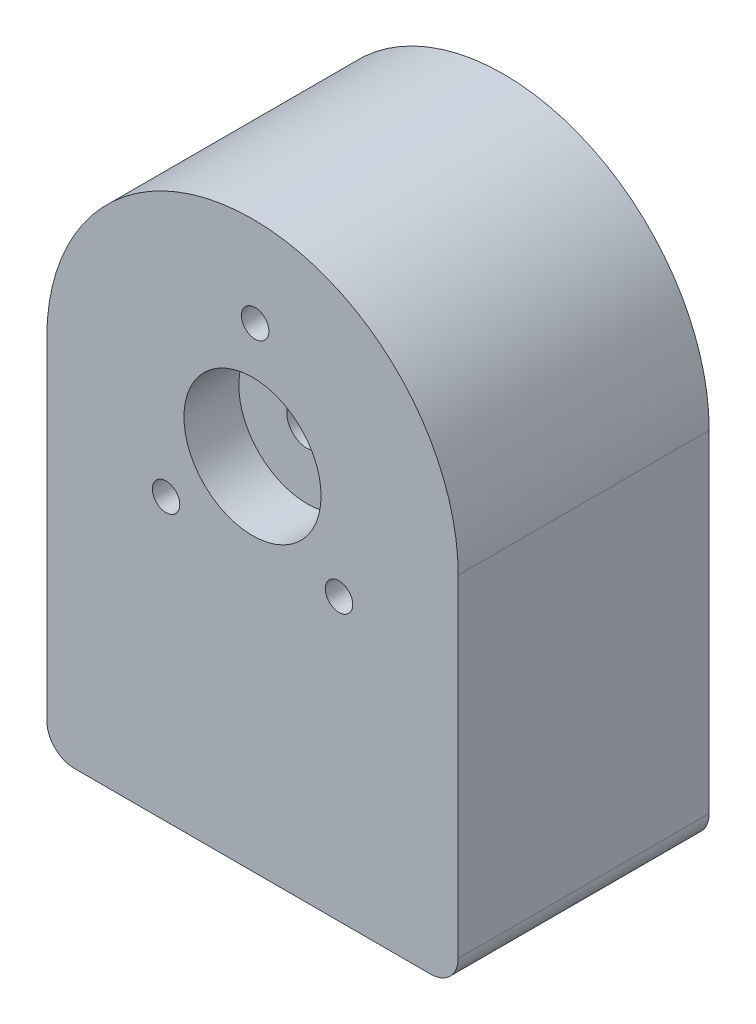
SolidWorks part; units mm, degrees
ref_plane "Front Plane" through (0, 0, 0) normal (0, 0, 1) x (1, 0, 0)
ref_plane "Top Plane" through (0, 0, 0) normal (0, 1, 0) x (1, 0, 0)
ref_plane "Right Plane" through (0, 0, 0) normal (1, 0, 0) x (0, 0, -1)
sketch "Sketch1" plane through (0, 0, 0) normal (0, 0, 1) x (1, 0, 0)
  line L0 (-26.4706, 11.5529) -> (-26.4706, -14.6471)
  line L1 (-26.4706, -14.6471) -> (3.5294, -14.6471)
  line L2 (3.5294, -14.6471) -> (3.5294, 11.5529)
  line L3 (-11.4706, -19.5882) -> (-11.4706, 31.9412) construction
  line L4 (8.9412, 11.5529) -> (-52.2353, 11.5529) construction
  arc A0 (3.5294, 11.5529) -> (-26.4706, 11.5529) centre (-11.4706, 11.5529) ccw
  dimension "D1" = 30
  dimension "D2" = 26.2
extrude "Boss-Extrude1" add sketch "Sketch1" along normal blind 18.3
sketch "Sketch2" plane through (0, 0, 18.3) normal (0, 0, 1) x (1, 0, 0)
  circle A0 centre (-11.4706, 11.5529) radius 5
  dimension "D1" = 10
extrude "Cut-Extrude1" cut sketch "Sketch2" against normal blind 4
sketch "Sketch3" plane through (0, 0, 14.3) normal (0, 0, 1) x (1, 0, 0)
  circle A0 centre (-11.4706, 11.5529) radius 1.5
  dimension "D1" = 3
extrude "Cut-Extrude2" cut sketch "Sketch3" against normal blind 9
sketch "Sketch5" plane through (0, 0, 18.3) normal (0, 0, 1) x (1, 0, 0)
  circle A0 centre (-11.2789, 20.0529) radius 1
  circle A1 centre (-11.4706, 11.5529) radius 1.5 construction
  circle A3 centre (-5.165, 5.8529) radius 1
  circle A4 centre (-17.7761, 5.8529) radius 1
  dimension "D1" = 2
  dimension "D4" = 2
  dimension "D6" = 2
  dimension "D2" = 8.5
  dimension "D5" = 14.2
extrude "Cut-Extrude6" cut sketch "Sketch5" against normal blind 8.7
fillet "Fillet2" radius 2 2 edges at (3.5294, -14.6471, 9.15) (-26.4706, -14.6471, 9.15)
